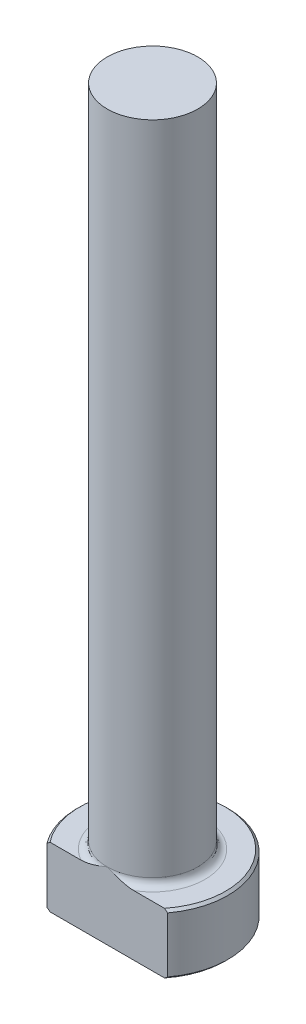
SolidWorks part; units mm, degrees
ref_plane "Front Plane" through (0, 0, 0) normal (0, 0, 1) x (1, 0, 0)
ref_plane "Top Plane" through (0, 0, 0) normal (0, 1, 0) x (1, 0, 0)
ref_plane "Right Plane" through (0, 0, 0) normal (1, 0, 0) x (0, 0, -1)
sketch "Sketch1" plane through (0, 0, 0) normal (0, 0, 1) x (1, 0, 0)
  line L0 (0, 259.9588) -> (0, -15.1925) construction
  line L1 (0, 0) -> (-7.9375, 0)
  line L2 (-7.9375, 0) -> (-7.9375, 6.35)
  line L3 (-7.9375, 6.35) -> (-4.7625, 6.35)
  line L4 (-4.7625, 6.35) -> (-4.7625, 76.2)
  line L5 (-4.7625, 76.2) -> (0, 76.2)
  line L6 (0, 76.2) -> (0, 0)
  dimension "L" = 76.2
  dimension "H" = 15.875
  dimension "T" = 6.35
  dimension "D" = 9.525
revolve "Revolve1" add sketch "Sketch1" angle 360 about L0
chamfer "Chamfer1" distance 0.254 angle 45 2 edges at (0, 6.35, 7.9375) (0, 0, 7.9375)
fillet "Fillet1" radius 0.762 1 edges at (0, 6.35, 4.7625)
sketch "Sketch2" plane through (0, 0, 0) normal (0, 1, 0) x (1, 0, 0)
  line L0 (-6.35, -4.7625) -> (6.35, -4.7625)
  circle A0 centre (0, 0) radius 7.9375 construction
  arc A1 (-6.35, -4.7625) -> (6.35, -4.7625) centre (0, 0) ccw
  circle A3 centre (0, 0) radius 4.7625 construction
  dimension "D1" = 0
extrude "Key" cut sketch "Sketch2" along normal through all
sketch "Pocket Sketch" plane through (0, 0, 0) normal (0, 0, 1) x (1, 0, 0)
  line L0 (-8.3344, 0) -> (-8.3344, 6.3754)
  line L1 (-8.3344, 6.3754) -> (-5.9214, 6.3754)
  line L2 (-5.1594, 7.1374) -> (-5.1594, 22.225)
  line L3 (-5.1594, 22.225) -> (0, 22.225)
  line L4 (0, 22.225) -> (0, 0)
  line L5 (0, 0) -> (-8.3344, 0)
  line L6 (0, 12.6104) -> (0, -2.4989) construction
  line L7 (-7.9375, 6.096) -> (-7.9375, 0.254) construction
  line L8 (7.6835, 6.35) -> (-7.6835, 6.35) construction
  line L9 (-4.7625, 76.2) -> (-4.7625, 7.112) construction
  line L10 (-5.9214, 6.3754) -> (-5.1594, 7.1374)
  point P3 (-5.1594, 6.3754)
  dimension "D1" = 16.6687
  dimension "D2" = 0.3969
  dimension "D3" = 0.0254
  dimension "D4" = 0.3969
  dimension "D5" = 10.3187
  dimension "D6" = 22.225
